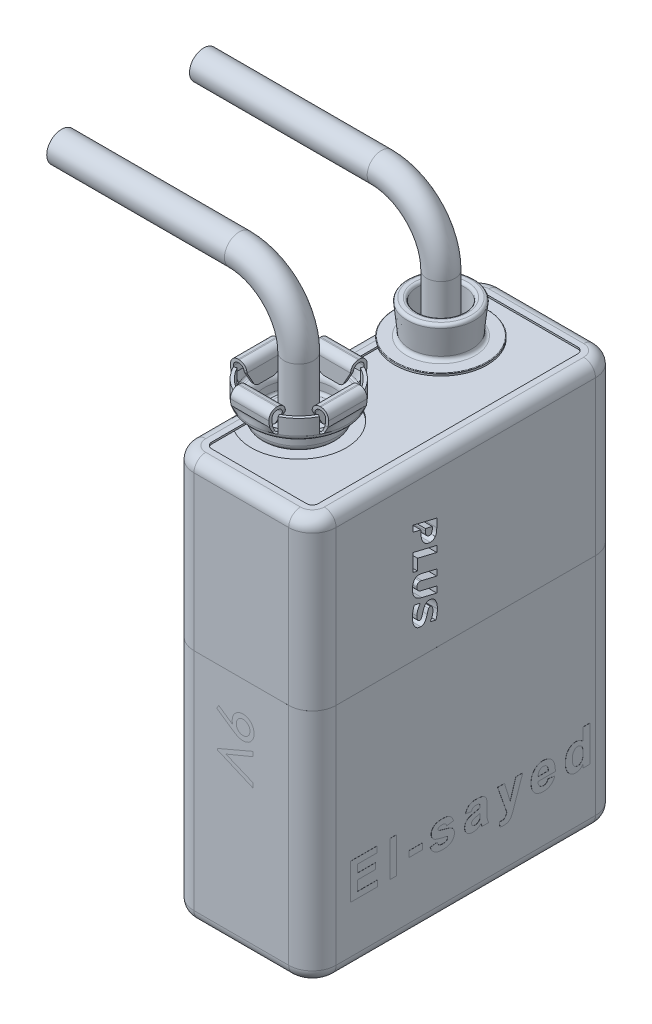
SolidWorks part; units mm, degrees
ref_plane "Front Plane" through (0, 0, 0) normal (0, 0, 1) x (1, 0, 0)
ref_plane "Top Plane" through (0, 0, 0) normal (0, 1, 0) x (1, 0, 0)
ref_plane "Right Plane" through (0, 0, 0) normal (1, 0, 0) x (0, 0, -1)
sketch "Sketch1" plane through (0, 0, 0) normal (0, 1, 0) x (1, 0, 0)
  line L1 (-10, 12.95) -> (-2, 12.95)
  line L2 (-12, 10.95) -> (-12, -10.95)
  line L3 (-10, -12.95) -> (-2, -12.95)
  line L4 (0, 10.95) -> (0, -10.95)
  arc A0 (-12, -10.95) -> (-10, -12.95) centre (-10, -10.95) ccw
  arc A1 (-2, -12.95) -> (0, -10.95) centre (-2, -10.95) ccw
  arc A2 (-2, 12.95) -> (0, 10.95) centre (-2, 10.95) cw
  arc A3 (-10, 12.95) -> (-12, 10.95) centre (-10, 10.95) ccw
  point P7 (-12, -12.95)
  point P12 (0, 12.95)
  point P15 (-12, 12.95)
  dimension "D3" = 2
  dimension "D1" = 12
  dimension "D2" = 25.9
extrude "Boss-Extrude1" add sketch "Sketch1" along normal blind 14
sketch "Sketch2" plane through (0, 14, 0) normal (0, 1, 0) x (-1, 0, 0)
  line L0 (0, 10.95) -> (0, -10.95) construction
  line L1 (10, -11.45) -> (2, -11.45)
  line L2 (10.5, -10.95) -> (10.5, 10.95)
  line L3 (10, 11.45) -> (2, 11.45)
  line L4 (1.5, -10.95) -> (1.5, 10.95)
  line L5 (12, -10.95) -> (12, 10.95) construction
  line L6 (2, -12.95) -> (10, -12.95) construction
  line L7 (10, 12.95) -> (2, 12.95) construction
  arc A0 (10.5, 10.95) -> (10, 11.45) centre (10, 10.95) ccw
  arc A1 (2, 11.45) -> (1.5, 10.95) centre (2, 10.95) ccw
  arc A2 (2, -11.45) -> (1.5, -10.95) centre (2, -10.95) cw
  arc A3 (10, -11.45) -> (10.5, -10.95) centre (10, -10.95) ccw
  point P10 (6, 12.95)
  dimension "D5" = 0.5
  dimension "D1" = 1.5
  dimension "D2" = 1.5
  dimension "D3" = 1.5
  dimension "D4" = 1.5
extrude "Cut-Extrude1" cut sketch "Sketch2" against normal blind 0.15
fillet "Fillet6" radius 1 8 edges at (-0.5858, 14, 12.3642) (-6, 14, 12.95) (-11.4142, 14, 12.3642) (-12, 14, 0) (-11.4142, 14, -12.3642) (-6, 14, -12.95) (-0.5858, 14, -12.3642) (0, 14, 0)
ref_plane "Plane2" through (0, -0.0001, 0) normal (0, -1, 0) x (1, 0, 0)
sketch "Sketch16" plane through (0, -0.0001, 0) normal (0, -1, 0) x (1, 0, 0)
  line L0 (-10, 12.95) -> (-2, 12.95)
  line L1 (-10, 12.95) -> (-2, 12.95) construction
  line L2 (-12, 10.95) -> (-12, -10.95)
  line L3 (-10, -12.95) -> (-2, -12.95)
  line L4 (0, 10.95) -> (0, -10.95)
  arc A0 (-10, 12.95) -> (-12, 10.95) centre (-10, 10.95) ccw construction
  arc A1 (-10, 12.95) -> (-12, 10.95) centre (-10, 10.95) ccw
  arc A2 (0, 10.95) -> (-2, 12.95) centre (-2, 10.95) ccw
  arc A3 (-12, -10.95) -> (-10, -12.95) centre (-10, -10.95) ccw
  arc A4 (-2, -12.95) -> (0, -10.95) centre (-2, -10.95) ccw
extrude "Boss-Extrude3" add sketch "Sketch16" along normal blind 20 separate body
ref_plane "Plane1" through (-8.55, 0, 0) normal (1, 0, 0) x (0, 0, -1)
sketch "Sketch4" plane through (-8.55, 0, 0) normal (1, 0, 0) x (0, 0, -1)
  line L0 (6.45, 49.3108) -> (6.45, 43.1213) construction
  line L1 (12.95, 13) -> (12.95, 0) construction
  line L2 (3.87, 16.85) -> (4.2, 16.85)
  line L4 (10.95, 13.85) -> (-10.95, 13.85) construction
  line L5 (4.45, 16.6) -> (4.45, 14.6)
  line L6 (4.7, 14.35) -> (5, 14.35)
  line L7 (5.25, 14.1) -> (5.25, 13.85)
  line L8 (5.25, 13.85) -> (2.55, 13.85)
  line L9 (2.55, 13.85) -> (2.55, 14)
  line L10 (2.6, 14.05) -> (3.55, 14.05)
  line L11 (3.8484, 14.3809) -> (3.6213, 16.5743)
  arc A0 (3.55, 14.05) -> (3.8484, 14.3809) centre (3.55, 14.35) ccw
  arc A1 (3.87, 16.85) -> (3.6213, 16.5743) centre (3.87, 16.6) ccw
  arc A2 (5, 14.35) -> (5.25, 14.1) centre (5, 14.1) cw
  arc A3 (4.45, 14.6) -> (4.7, 14.35) centre (4.7, 14.6) ccw
  arc A4 (4.45, 16.6) -> (4.2, 16.85) centre (4.2, 16.6) ccw
  arc A5 (2.55, 14) -> (2.6, 14.05) centre (2.6, 14) cw
  point P19 (3.5928, 16.85)
  point P23 (4.45, 14.35)
  point P26 (4.45, 16.85)
  point P29 (2.55, 14.05)
  dimension "D9" = 0.3
  dimension "D10" = 0.25
  dimension "D12" = 0.25
  dimension "D13" = 0.25
  dimension "D14" = 0.05
  dimension "D1" = 6.5
  dimension "D2" = 3
  dimension "D3" = 2.58
  dimension "D4" = 3.9
  dimension "D5" = 0.2
  dimension "D6" = 2
  dimension "D7" = 2.5
  dimension "D8" = 1.2
  dimension "D11" = 2.9
revolve "Revolve1" add sketch "Sketch4" angle 360 about L0
sketch "Sketch5" plane through (-8.55, 0, 0) normal (1, 0, 0) x (0, 0, -1)
  line L0 (-5.55, 48.6561) -> (-5.55, 41.4975) construction
  line L1 (6.45, 13.2782) -> (6.45, 15.7435) construction
  line L2 (10.95, 13.85) -> (9.8275, 13.85) construction
  line L3 (-5.55, 13.85) -> (-9.55, 13.85)
  line L4 (-5.55, 13.85) -> (-5.55, 13.7)
  line L5 (-5.55, 13.7) -> (-9.55, 13.7)
  line L6 (-9.55, 13.85) -> (-9.55, 13.7)
  dimension "D1" = 12
  dimension "D2" = 0.15
  dimension "D3" = 0.15
  dimension "D4" = 4
revolve "Cut-Revolve1" cut sketch "Sketch5" angle 360 about L0
sketch "Sketch6" plane through (-8.55, 0, 0) normal (1, 0, 0) x (0, 0, -1)
  line L0 (-5.55, 48.7474) -> (-5.55, 43.448) construction
  line L1 (6.45, 13.2782) -> (6.45, 15.7435) construction
  line L2 (-8.7, 14.8) -> (-8.7, 14.2)
  line L3 (-1.55, 13.7) -> (-9.55, 13.7) construction
  line L4 (-8.2, 13.7) -> (-6.8, 13.7)
  line L5 (-6.8, 13.7) -> (-6.8, 13.95)
  line L6 (-6.8, 13.95) -> (-8.2, 13.95)
  line L8 (-9.65, 16.9) -> (-9.65, 15.6)
  line L9 (-9.65, 16.9) -> (-9.4, 16.9)
  line L10 (-9.4, 16.9) -> (-9.4, 15.6)
  line L11 (-9.1, 15.2) -> (-9.25, 15.2)
  line L12 (-8.2, 13.95) -> (-6.8, 13.95)
  line L13 (-8.45, 14.8) -> (-8.45, 14.2)
  line L14 (-9.25, 15.45) -> (-9.1, 15.45)
  line L15 (-8.2, 13.7) -> (-5.55, 13.7) construction
  line L18 (-8.2, 13.95) -> (-5.55, 13.95) construction
  line L19 (-9.4, 16.9) -> (-9.4, 15.5248) construction
  line L20 (-9.1, 15.45) -> (-9.1615, 15.45) construction
  line L21 (-9.1615, 15.45) -> (-9.1615, 15.45) construction
  line L22 (-9.1615, 15.45) -> (-9.1615, 15.45) construction
  line L23 (-9.1615, 15.45) -> (-9.1615, 15.45) construction
  arc A0 (-8.7, 14.2) -> (-8.2, 13.7) centre (-8.2, 14.2) ccw
  arc A1 (-8.7, 14.8) -> (-9.1, 15.2) centre (-9.1, 14.8) ccw
  arc A2 (-9.25, 15.2) -> (-9.65, 15.6) centre (-9.25, 15.6) cw
  arc A3 (-8.45, 14.2) -> (-8.2, 13.95) centre (-8.2, 14.2) ccw
  arc A4 (-8.45, 14.8) -> (-9.1, 15.45) centre (-9.1, 14.8) ccw
  arc A6 (-9.4, 15.6) -> (-9.25, 15.45) centre (-9.25, 15.6) ccw
  arc A7 (-9.1615, 15.45) -> (-9.1615, 15.45) centre (-9.1615, 15.45) cw construction
  point P15 (-8.7, 13.7)
  point P22 (-8.7, 15.2)
  dimension "D2" = 0.5
  dimension "D9" = 0.4
  dimension "D10" = 0.4
  dimension "D12" = 0.15
  dimension "D1" = 12
  dimension "D3" = 3.15
  dimension "D4" = 1.25
  dimension "D5" = 4.1
  dimension "D6" = 3.2
  dimension "D7" = 0.25
  dimension "D8" = 1
  dimension "D13" = 0.25
revolve "Revolve2" add sketch "Sketch6" angle 360 about L0
sketch "Sketch7" plane through (0, 16.9, 0) normal (0, 1, 0) x (1, 0, 0)
  line L0 (-10.2183, -2.3599) -> (-10.45, -1.9168)
  line L1 (-8.55, -1.7) -> (-8.55, -1.45)
  line L2 (-8.55, -20.1056) -> (-8.55, 20.1056) construction
  line L3 (-8.55, -1.45) -> (-8.55, -5.55) construction
  line L4 (-6.8817, -2.3599) -> (-6.65, -1.9168)
  circle A0 centre (-8.55, -5.55) radius 4.1 construction
  arc A1 (-6.65, -1.9168) -> (-10.45, -1.9168) centre (-8.55, -5.55) ccw
  arc A2 (-6.8817, -2.3599) -> (-10.2183, -2.3599) centre (-8.55, -5.55) ccw
  dimension "D1" = 1.9
  dimension "D2" = 0.5
  dimension "D3" = 27.608
extrude "Cut-Extrude4" cut sketch "Sketch7" against normal blind 1.3 contours L3 L0 A2 M1 | L3 A2 L4 M1 | L4 L1 M1 M2 | L1 L0 M1 M2
sketch "Sketch19" plane through (0, -20.0001, 0) normal (0, -1, 0) x (1, 0, 0)
  line L0 (-10, -12.95) -> (-2, -12.95) construction
  line L1 (-9.5, 10.95) -> (-2.5, 10.95)
  line L2 (-10, 10.45) -> (-10, -10.45)
  line L3 (-9.5, -10.95) -> (-2.5, -10.95)
  line L4 (-2, 10.45) -> (-2, -10.45)
  line L5 (0, -10.95) -> (0, 10.95) construction
  line L6 (-2, 12.95) -> (-10, 12.95) construction
  line L7 (-12, 10.95) -> (-12, -10.95) construction
  arc A0 (-10, -10.45) -> (-9.5, -10.95) centre (-9.5, -10.45) ccw
  arc A1 (-2.5, -10.95) -> (-2, -10.45) centre (-2.5, -10.45) ccw
  arc A2 (-2.5, 10.95) -> (-2, 10.45) centre (-2.5, 10.45) cw
  arc A3 (-9.5, 10.95) -> (-10, 10.45) centre (-9.5, 10.45) ccw
  dimension "D5" = 0.5
  dimension "D1" = 2
  dimension "D2" = 2
  dimension "D3" = 2
  dimension "D4" = 2
extrude "Cut-Extrude6" cut sketch "Sketch19" against normal blind 0.15
fillet "Fillet3" radius 0.1 2 edges at (-6.7079, 15.6, 2.0276) (-10.3921, 15.6, 2.0276)
pattern_circular "CirPattern4" count 4 over 360 about axis through (-8.55, 0, 5.55) along (0, 1, 0) of "Cut-Extrude4", "Fillet3"
sketch "Sketch9" plane through (-8.55, 0, 0) normal (1, 0, 0) x (0, 0, -1)
  line L0 (-8.3, 15.45) -> (-8.3, 16.75)
  line L1 (-8.95, 17.4) -> (-9.0436, 17.4)
  line L2 (-5.55, 15.6) -> (-5.55, 16.9) construction
  line L3 (-5.55, 13.4219) -> (-5.55, 19.9562) construction
  line L4 (-7.3341, 16.9) -> (-8.9616, 16.9) construction
  line L5 (-1.85, 15.45) -> (-9.25, 15.45) construction
  line L6 (-8.3, 15.45) -> (-8.55, 15.45)
  line L7 (-8.55, 15.45) -> (-8.55, 16.75)
  line L8 (-8.95, 17.15) -> (-9.0436, 17.15)
  line L9 (-9.6913, 16.696) -> (-9.65, 16.2)
  line L10 (-9.2284, 15.6) -> (-9.65, 15.6) construction
  line L11 (-9.3991, 16.2) -> (-9.4422, 16.7168)
  line L12 (-9.65, 16.2) -> (-9.3991, 16.2)
  arc A0 (-8.55, 16.75) -> (-8.95, 17.15) centre (-8.95, 16.75) ccw
  arc A1 (-9.4422, 16.7168) -> (-9.0436, 17.15) centre (-9.0436, 16.75) cw
  arc A2 (-8.3, 16.75) -> (-8.95, 17.4) centre (-8.95, 16.75) ccw
  arc A3 (-9.6913, 16.696) -> (-9.0436, 17.4) centre (-9.0436, 16.75) cw
  point P26 (-9.75, 17.4)
  dimension "D9" = 0.4
  dimension "D10" = 0.65
  dimension "D1" = 2.75
  dimension "D2" = 0.5
  dimension "D3" = 4.2
  dimension "D4" = 0.25
  dimension "D5" = 0.25
  dimension "D6" = 0.6
  dimension "D7" = 4.1
  dimension "D8" = 0.25
extrude "Boss-Extrude2" add sketch "Sketch9" along normal mid plane 3.25 separate body
sketch "Sketch10" plane through (0, 15.6, 0) normal (0, 1, 0) x (1, 0, 0)
  line L0 (-10.0759, -9.0847) -> (-10.175, -9.3142)
  line L1 (-7.0241, -9.0847) -> (-6.925, -9.3142)
  line L2 (-8.55, -5.55) -> (-8.55, -9.65) construction
  arc A0 (-10.3608, -9.2284) -> (-6.7392, -9.2284) centre (-8.55, -5.55) ccw construction
  arc A1 (-10.175, -9.3142) -> (-6.925, -9.3142) centre (-8.55, -5.55) ccw
  arc A2 (-10.0759, -9.0847) -> (-7.0241, -9.0847) centre (-8.55, -5.55) ccw
  circle A3 centre (-8.55, -5.55) radius 3.55 construction
  dimension "D3" = 0.3
  dimension "D1" = 3.25
  dimension "D2" = 1.625
  dimension "D4" = 1.5259
  dimension "D5" = 3.0518
sketch "Sketch11" plane through (0, 16.2, 0) normal (0, -1, 0) x (1, 0, 0)
  line L1 (-10.175, 9.65) -> (-6.925, 9.65)
  line L2 (-10.175, 9.65) -> (-10.175, 9.3991)
  line L3 (-10.175, 9.3991) -> (-6.925, 9.3991)
  line L4 (-6.925, 9.65) -> (-6.925, 9.3991)
loft "Loft1" add profiles "Sketch11", "Sketch10"
fillet "Fillet4" radius 0.1 5 edges
sketch "Sketch12" plane through (0, 0, 8.3) normal (0, 0, -1) x (-1, 0, 0)
  line L0 (6.925, 16.75) -> (7.65, 15.45)
  line L1 (6.925, 15.45) -> (10.175, 15.45) construction
  line L2 (7.65, 15.45) -> (6.925, 15.45)
  line L3 (6.925, 15.45) -> (6.925, 16.75)
  line L4 (10.175, 16.75) -> (9.45, 15.45)
  line L5 (9.45, 15.45) -> (10.175, 15.45)
  line L6 (10.175, 15.45) -> (10.175, 16.75) construction
  line L7 (10.175, 15.45) -> (10.175, 16.75)
  dimension "D1" = 1.8
  dimension "D2" = 0.725
extrude "Cut-Extrude5" cut sketch "Sketch12" against normal blind 0.25
fillet "Fillet5" radius 0.5 4 edges at (-6.925, 16.75, 8.425) (-10.175, 16.75, 8.425) (-9.45, 15.45, 8.425) (-7.65, 15.45, 8.425)
pattern_circular "CirPattern6" count 4 over 360 about axis through (-8.55, 48.7474, 5.55) along (0, 1, 0) of "Fillet5", "Cut-Extrude5", "Fillet4", "Loft1", "Boss-Extrude2"
fillet "Fillet7" radius 1 8 edges at (-0.5858, -20.0001, -12.3642) (-6, -20.0001, -12.95) (-11.4142, -20.0001, -12.3642) (-12, -20.0001, 0) (-11.4142, -20.0001, 12.3642) (-6, -20.0001, 12.95) (-0.5858, -20.0001, 12.3642) (0, -20.0001, 0)
sketch "Sketch13" plane through (0, 0, 0) normal (1, 0, 0) x (0, 0, -1)
  line L0 (-10.05, -15.0001) -> (12.95, -15.0001) construction
  line L2 (12.95, -19.0001) -> (12.95, -0.0001) construction
  text T0 "El-sayed" height 3
  point P2 (-9.8062, 0)
  point P3 (-10.4262, -4.9827)
  point P6 (0, 0)
  point P7 (-36.813, 0)
  point P8 (-22.8495, 0)
  point P9 (12.3636, -10.7876)
  point P14 (-7.05, -15.0001)
  point P15 (-9.05, -15.0001)
  point P16 (37.8588, -3.3685)
  point P17 (0, 0)
  dimension "D1" = 5
  dimension "D2" = 23
wrap "Wrap1" sketch "Sketch13" wrap type emboss source sketch "Sketch13" thickness 0.01 parameters "D1"=0.01
sketch "Sketch14" plane through (0, 0, 0) normal (1, 0, 0) x (0, 0, -1)
  line L0 (-4.45, 9.9999) -> (-4.45, -0.0001) construction
  line L1 (-12.95, 13) -> (-12.95, 0) construction
  line L2 (10.95, -20.0001) -> (-10.95, -20.0001) construction
  text T0 "<b>PLUS</b>" font "Verdana" height 2
  dimension "D1" = 10
  dimension "D2" = 20
  dimension "D3" = 8.5
sketch "Sketch17" plane through (0, 0, 12.95) normal (0, 0, 1) x (1, 0, 0)
  line L0 (-8, -2.0001) -> (-8, -8.0001) construction
  line L1 (-10, -19.0001) -> (-10, -0.0001) construction
  line L2 (-2, -0.0001) -> (-10, -0.0001) construction
  text T0 "<b>9V</b>" font "Century Gothic" height 3
  dimension "D1" = 2
  dimension "D2" = 6
  dimension "D3" = 2
wrap "Wrap3" sketch "Sketch17" wrap type scribe source sketch "Sketch17"
sketch "Sketch18" plane through (0, 0, -12.95) normal (0, 0, -1) x (-1, 0, 0)
  line L0 (9, 3.5) -> (9, 2)
  line L1 (8, 6) -> (9, 6)
  line L2 (8, 6) -> (8, 4.5)
  line L3 (8, 2) -> (9, 2)
  line L4 (9, 6) -> (9, 4.5)
  line L5 (6.5, 4.5) -> (8, 4.5)
  line L6 (6.5, 4.5) -> (6.5, 3.5)
  line L7 (6.5, 3.5) -> (8, 3.5)
  line L8 (10.5, 4.5) -> (10.5, 3.5)
  line L9 (8, 3.5) -> (8, 2)
  line L10 (9, 4.5) -> (10.5, 4.5)
  line L11 (9, 3.5) -> (10.5, 3.5)
  line L12 (2, 0) -> (10, 0) construction
  line L13 (2, -19.0001) -> (2, -0.0001) construction
  dimension "D1" = 4
  dimension "D2" = 4
  dimension "D3" = 1
  dimension "D4" = 1
  dimension "D5" = 1.5
  dimension "D6" = 1.5
  dimension "D7" = 2
  dimension "D8" = 6
wrap "Wrap4" sketch "Sketch18" wrap type scribe source sketch "Sketch18"
wrap "Wrap5" sketch "Sketch14" wrap type deboss source sketch "Sketch14" thickness 2 parameters "D1"=2
sketch "Sketch20" plane through (0, 13.85, 0) normal (0, 1, 0) x (1, 0, 0)
  circle A1 centre (-8.55, 6.45) radius 1.2
  circle A2 centre (-8.55, 6.45) radius 1.2
  circle A3 centre (-8.55, -5.55) radius 1.25
  circle A4 centre (-8.55, -5.55) radius 1.25
  point P1 (-8.55, -5.55)
  point P8 (-8.55, 6.45)
  dimension "D1" = 0
  dimension "D2" = 0
sketch "Sketch21" plane through (0, 0, 12.95) normal (0, 0, 1) x (1, 0, 0)
  line L0 (-8.575, 13.85) -> (-8.575, 18.85)
  line L1 (-13.575, 23.85) -> (-28.575, 23.85)
  line L3 (-7.3, 13.85) -> (-9.8, 13.85)
  line L4 (-7.35, 13.85) -> (-9.8, 13.85) construction
  line L5 (-7.35, 13.85) -> (-9.75, 13.85)
  line L6 (-7.35, 13.85) -> (-9.75, 13.85) construction
  arc A0 (-8.575, 18.85) -> (-13.575, 23.85) centre (-13.575, 18.85) ccw
  point P7 (-8.575, 13.85)
  dimension "D3" = 5
  dimension "D1" = 0
  dimension "D4" = 15
  dimension "D5" = 5
  dimension "D2" = 0
sweep "Sweep1" add profiles "Sketch20" path "Sketch21"
